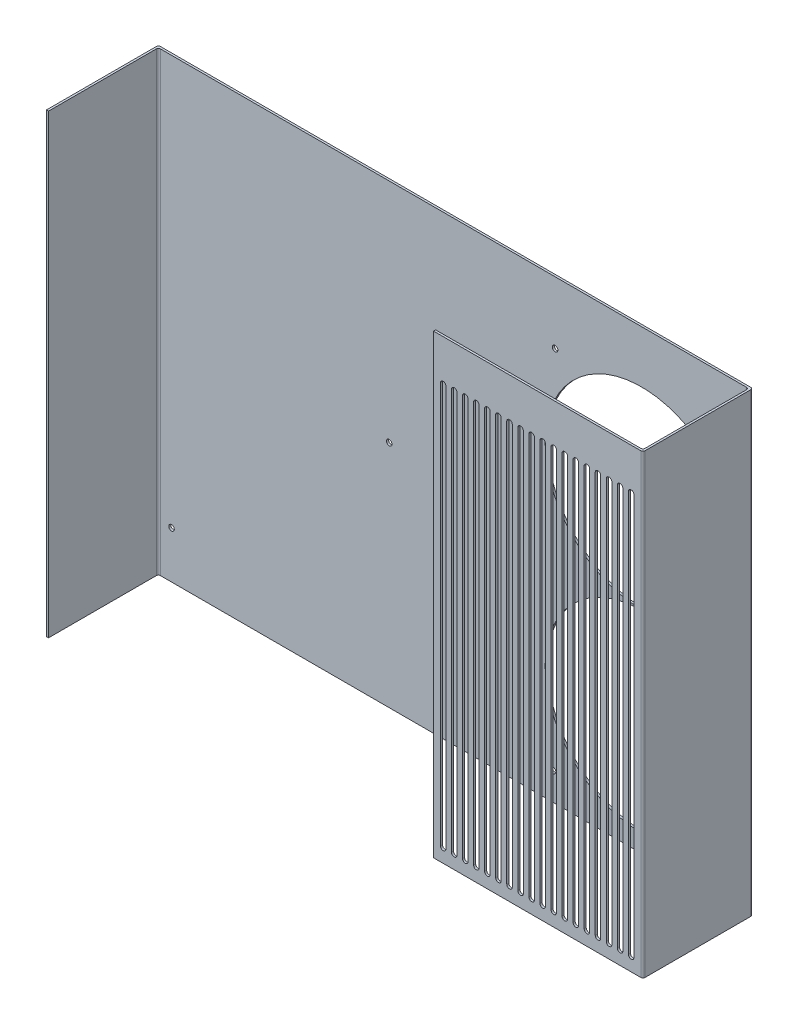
SolidWorks part; units mm, degrees
ref_plane "Plan de face" through (0, 0, 0) normal (0, 0, 1) x (1, 0, 0)
ref_plane "Plan de dessus" through (0, 0, 0) normal (0, 1, 0) x (1, 0, 0)
ref_plane "Plan de droite" through (0, 0, 0) normal (1, 0, 0) x (0, 0, -1)
sketch "Esquisse1" plane through (0, 0, 0) normal (0, 0, 1) x (1, 0, 0)
  line L1 (-253.0172, 157.8488) -> (176.9828, 157.8488)
  line L2 (-253.0172, 157.8488) -> (-253.0172, -172.1512)
  line L3 (-253.0172, -172.1512) -> (176.9828, -172.1512)
  line L4 (176.9828, 157.8488) -> (176.9828, -172.1512)
  dimension "D1" = 330
  dimension "D2" = 430
extrude "Boss.-Extru.1" add sketch "Esquisse1" along normal blind 1.5
sketch "Esquisse2" plane through (0, 0, 1.5) normal (0, 0, 1) x (1, 0, 0)
  line L0 (176.9828, 157.8488) -> (-253.0172, 157.8488) construction
  line L1 (-253.0172, -172.1512) -> (-251.5172, -172.1512)
  line L2 (-253.0172, -172.1512) -> (-253.0172, 157.8488)
  line L3 (-253.0172, 157.8488) -> (-251.5172, 157.8488)
  line L4 (-251.5172, -172.1512) -> (-251.5172, 157.8488)
  dimension "D1" = 1.5
extrude "Boss.-Extru.2" add sketch "Esquisse2" along normal blind 79.5
sketch "Esquisse3" plane through (0, 0, 1.5) normal (0, 0, 1) x (1, 0, 0)
  line L0 (-251.5172, -172.1512) -> (176.9828, -172.1512) construction
  line L1 (176.9828, 157.8488) -> (175.4828, 157.8488)
  line L2 (176.9828, 157.8488) -> (176.9828, -172.1512)
  line L3 (176.9828, -172.1512) -> (175.4828, -172.1512)
  line L4 (175.4828, 157.8488) -> (175.4828, -172.1512)
  dimension "D1" = 1.5
extrude "Boss.-Extru.3" add sketch "Esquisse3" along normal blind 78
sketch "Esquisse4" plane through (175.4828, 0, 0) normal (-1, 0, 0) x (0, 0, 1)
  line L0 (79.5, 157.8488) -> (1.5, 157.8488) construction
  line L1 (79.5, -172.1512) -> (78, -172.1512)
  line L2 (79.5, -172.1512) -> (79.5, 157.8488)
  line L3 (79.5, 157.8488) -> (78, 157.8488)
  line L4 (78, -172.1512) -> (78, 157.8488)
  dimension "D1" = 1.5
extrude "Boss.-Extru.4" add sketch "Esquisse4" along normal blind 150
fillet "Congé1" radius 1.5 6 edges at (176.9828, -7.1512, 0) (175.4828, -7.1512, 78) (175.4828, -7.1512, 1.5) (176.9828, -7.1512, 79.5) (-251.5172, -7.1512, 1.5) (-253.0172, -7.1512, 0)
sketch "Esquisse6" plane through (0, 0, 1.5) normal (0, 0, 1) x (1, 0, 0)
  line L0 (-250.0172, -172.1512) -> (173.9828, -172.1512) construction
  line L1 (-250.0172, 157.8488) -> (-250.0172, -172.1512) construction
  circle A0 centre (-242.0172, -138.1512) radius 2
  circle A1 centre (-84.5372, -6.0712) radius 2
  dimension "D2" = 4
  dimension "D4" = 4
  dimension "D1" = 34
  dimension "D3" = 8
  dimension "D5" = 157.48
  dimension "D6" = 132.08
extrude "Enlèv. mat.-Extru.1" cut sketch "Esquisse6" against normal blind 3
sketch "Esquisse7" plane through (0, 0, 0) normal (0, 0, -1) x (-1, 0, 0)
  line L3 (-175.4828, 157.8488) -> (251.5172, 157.8488) construction
  line L5 (-175.4828, 157.8488) -> (-175.4828, -172.1512) construction
  circle A0 centre (-160.4828, -152.1512) radius 2
  circle A1 centre (-35.4828, 112.8488) radius 2
  circle A2 centre (-160.4828, 112.8488) radius 2
  circle A3 centre (-33.9828, -152.1469) radius 2
  circle A4 centre (-97.9828, 50.3488) radius 69.75
  circle A5 centre (-97.9828, -89.6469) radius 69.75
  dimension "D5" = 4
  dimension "D6" = 4
  dimension "D7" = 4
  dimension "D8" = 4
  dimension "D11" = 139.5
  dimension "D12" = 139.5
  dimension "D1" = 125
  dimension "D2" = 45
  dimension "D3" = 62.5
  dimension "D4" = 15
  dimension "D9" = 265
  dimension "D10" = 62.5
  dimension "D13" = 62.5
  dimension "D14" = 62.5
  dimension "D15" = 125
  dimension "D16" = 265
  dimension "D17" = 45
extrude "Enlèv. mat.-Extru.2" cut sketch "Esquisse7" against normal blind 3
sketch "Esquisse9" plane through (0, 0, 79.5) normal (0, 0, 1) x (1, 0, 0)
  line L0 (170.4828, -162.1512) -> (170.4828, 127.8488)
  line L1 (166.4828, -162.1512) -> (166.4828, 127.8488)
  line L2 (175.4828, -172.1512) -> (175.4828, 157.8488) construction
  line L3 (25.4828, -172.1512) -> (175.4828, -172.1512) construction
  line L4 (162.4828, -162.1512) -> (162.4828, 127.8488)
  line L5 (158.4828, -162.1512) -> (158.4828, 127.8488)
  line L6 (154.4828, -162.1512) -> (154.4828, 127.8488)
  line L7 (150.4828, -162.1512) -> (150.4828, 127.8488)
  line L8 (146.4828, -162.1512) -> (146.4828, 127.8488)
  line L9 (142.4828, -162.1512) -> (142.4828, 127.8488)
  line L10 (138.4828, -162.1512) -> (138.4828, 127.8488)
  line L11 (134.4828, -162.1512) -> (134.4828, 127.8488)
  line L12 (130.4828, -162.1512) -> (130.4828, 127.8488)
  line L13 (126.4828, -162.1512) -> (126.4828, 127.8488)
  line L14 (122.4828, -162.1512) -> (122.4828, 127.8488)
  line L15 (118.4828, -162.1512) -> (118.4828, 127.8488)
  line L16 (114.4828, -162.1512) -> (114.4828, 127.8488)
  line L17 (110.4828, -162.1512) -> (110.4828, 127.8488)
  line L18 (106.4828, -162.1512) -> (106.4828, 127.8488)
  line L19 (102.4828, -162.1512) -> (102.4828, 127.8488)
  line L20 (98.4828, -162.1512) -> (98.4828, 127.8488)
  line L21 (94.4828, -162.1512) -> (94.4828, 127.8488)
  line L22 (90.4828, -162.1512) -> (90.4828, 127.8488)
  line L23 (86.4828, -162.1512) -> (86.4828, 127.8488)
  line L24 (82.4828, -162.1512) -> (82.4828, 127.8488)
  line L25 (78.4828, -162.1512) -> (78.4828, 127.8488)
  line L26 (74.4828, -162.1512) -> (74.4828, 127.8488)
  line L27 (70.4828, -162.1512) -> (70.4828, 127.8488)
  line L28 (66.4828, -162.1512) -> (66.4828, 127.8488)
  line L29 (62.4828, -162.1512) -> (62.4828, 127.8488)
  line L30 (58.4828, -162.1512) -> (58.4828, 127.8488)
  line L31 (54.4828, -162.1512) -> (54.4828, 127.8488)
  line L32 (50.4828, -162.1512) -> (50.4828, 127.8488)
  line L33 (46.4828, -162.1512) -> (46.4828, 127.8488)
  line L34 (42.4828, -162.1512) -> (42.4828, 127.8488)
  line L35 (38.4828, -162.1512) -> (38.4828, 127.8488)
  line L36 (34.4828, -162.1512) -> (34.4828, 127.8488)
  line L37 (30.4828, -162.1512) -> (30.4828, 127.8488)
  line L39 (175.4828, 157.8488) -> (25.4828, 157.8488) construction
  arc A0 (170.4828, -162.1512) -> (166.4828, -162.1512) centre (168.4828, -162.1512) cw
  arc A1 (170.4828, 127.8488) -> (166.4828, 127.8488) centre (168.4828, 127.8488) ccw
  arc A2 (162.4828, -162.1512) -> (158.4828, -162.1512) centre (160.4828, -162.1512) cw
  arc A3 (162.4828, 127.8488) -> (158.4828, 127.8488) centre (160.4828, 127.8488) ccw
  arc A4 (154.4828, -162.1512) -> (150.4828, -162.1512) centre (152.4828, -162.1512) cw
  arc A5 (154.4828, 127.8488) -> (150.4828, 127.8488) centre (152.4828, 127.8488) ccw
  arc A6 (146.4828, -162.1512) -> (142.4828, -162.1512) centre (144.4828, -162.1512) cw
  arc A7 (146.4828, 127.8488) -> (142.4828, 127.8488) centre (144.4828, 127.8488) ccw
  arc A8 (138.4828, -162.1512) -> (134.4828, -162.1512) centre (136.4828, -162.1512) cw
  arc A9 (138.4828, 127.8488) -> (134.4828, 127.8488) centre (136.4828, 127.8488) ccw
  arc A10 (130.4828, -162.1512) -> (126.4828, -162.1512) centre (128.4828, -162.1512) cw
  arc A11 (130.4828, 127.8488) -> (126.4828, 127.8488) centre (128.4828, 127.8488) ccw
  arc A12 (122.4828, -162.1512) -> (118.4828, -162.1512) centre (120.4828, -162.1512) cw
  arc A13 (122.4828, 127.8488) -> (118.4828, 127.8488) centre (120.4828, 127.8488) ccw
  arc A14 (114.4828, -162.1512) -> (110.4828, -162.1512) centre (112.4828, -162.1512) cw
  arc A15 (114.4828, 127.8488) -> (110.4828, 127.8488) centre (112.4828, 127.8488) ccw
  arc A16 (106.4828, -162.1512) -> (102.4828, -162.1512) centre (104.4828, -162.1512) cw
  arc A17 (106.4828, 127.8488) -> (102.4828, 127.8488) centre (104.4828, 127.8488) ccw
  arc A18 (98.4828, -162.1512) -> (94.4828, -162.1512) centre (96.4828, -162.1512) cw
  arc A19 (98.4828, 127.8488) -> (94.4828, 127.8488) centre (96.4828, 127.8488) ccw
  arc A20 (90.4828, -162.1512) -> (86.4828, -162.1512) centre (88.4828, -162.1512) cw
  arc A21 (90.4828, 127.8488) -> (86.4828, 127.8488) centre (88.4828, 127.8488) ccw
  arc A22 (82.4828, -162.1512) -> (78.4828, -162.1512) centre (80.4828, -162.1512) cw
  arc A23 (82.4828, 127.8488) -> (78.4828, 127.8488) centre (80.4828, 127.8488) ccw
  arc A24 (74.4828, -162.1512) -> (70.4828, -162.1512) centre (72.4828, -162.1512) cw
  arc A25 (74.4828, 127.8488) -> (70.4828, 127.8488) centre (72.4828, 127.8488) ccw
  arc A26 (66.4828, -162.1512) -> (62.4828, -162.1512) centre (64.4828, -162.1512) cw
  arc A27 (66.4828, 127.8488) -> (62.4828, 127.8488) centre (64.4828, 127.8488) ccw
  arc A28 (58.4828, -162.1512) -> (54.4828, -162.1512) centre (56.4828, -162.1512) cw
  arc A29 (58.4828, 127.8488) -> (54.4828, 127.8488) centre (56.4828, 127.8488) ccw
  arc A30 (50.4828, -162.1512) -> (46.4828, -162.1512) centre (48.4828, -162.1512) cw
  arc A31 (50.4828, 127.8488) -> (46.4828, 127.8488) centre (48.4828, 127.8488) ccw
  arc A32 (42.4828, -162.1512) -> (38.4828, -162.1512) centre (40.4828, -162.1512) cw
  arc A33 (42.4828, 127.8488) -> (38.4828, 127.8488) centre (40.4828, 127.8488) ccw
  arc A34 (34.4828, -162.1512) -> (30.4828, -162.1512) centre (32.4828, -162.1512) cw
  arc A35 (34.4828, 127.8488) -> (30.4828, 127.8488) centre (32.4828, 127.8488) ccw
  point P112 (0, 0)
  point P115 (0, 0)
  dimension "D1" = 0
  dimension "D2" = 5
  dimension "D3" = 4
  dimension "D4" = 30
  dimension "D6" = 10
  dimension "D8" = 4
  dimension "D7" = 18
extrude "Enlèv. mat.-Extru.3" cut sketch "Esquisse9" against normal blind 3
